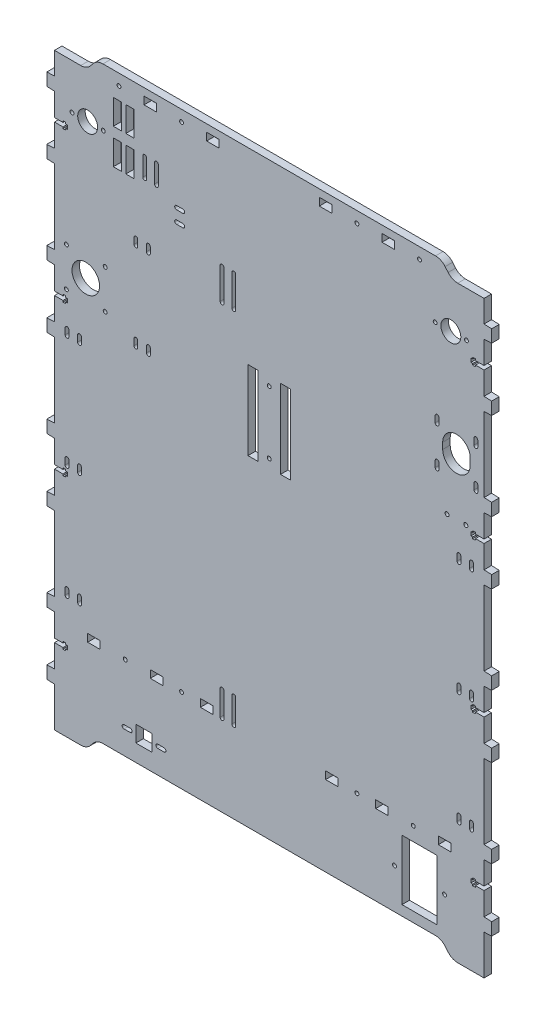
SolidWorks part; units mm, degrees
ref_plane "Спереди" through (0, 0, 0) normal (0, 0, 1) x (1, 0, 0)
ref_plane "Сверху" through (0, 0, 0) normal (0, 1, 0) x (1, 0, 0)
ref_plane "Справа" through (0, 0, 0) normal (1, 0, 0) x (0, 0, -1)
sketch "Эскиз1" plane through (0, 0, 0) normal (0, 0, 1) x (1, 0, 0)
  line L0 (161, 62) -> (177.8027, 62) construction
  line L1 (0, 77) -> (151.5411, 77) construction
  line L2 (157.5, 434) -> (132.5, 434) construction
  line L3 (85, 80.05) -> (95, 80.05)
  line L4 (95, 73.95) -> (85, 73.95)
  line L5 (85, 73.95) -> (85, 80.05)
  line L6 (95, 80.05) -> (95, 73.95)
  line L7 (135, 80.05) -> (145, 80.05)
  line L8 (145, 73.95) -> (135, 73.95)
  line L9 (135, 73.95) -> (135, 80.05)
  line L10 (145, 80.05) -> (145, 73.95)
  line L11 (9, 298.5) -> (0, 298.5) construction
  line L12 (177.6, 37) -> (162.5, 37) construction
  line L13 (171.5, 92.25) -> (177.6, 92)
  line L14 (177.6, 82) -> (171.5, 81.75)
  line L15 (177.6, 92) -> (177.6, 82)
  line L16 (162.5, 63.55) -> (161, 63.55)
  line L17 (162.5, 64.75) -> (162.5, 63.55)
  line L18 (164.7, 64.75) -> (162.5, 64.75)
  line L19 (164.7, 63.55) -> (164.7, 64.75)
  line L20 (100, 468.05) -> (90, 468.05)
  line L21 (90, 468.05) -> (90, 474.15)
  line L22 (90, 474.15) -> (100, 474.15)
  line L23 (100, 474.15) -> (100, 468.05)
  line L24 (50, 468.05) -> (40, 468.05)
  line L25 (40, 468.05) -> (40, 474.15)
  line L26 (40, 474.15) -> (50, 474.15)
  line L27 (50, 474.15) -> (50, 468.05)
  line L28 (55, 73.95) -> (45, 73.95)
  line L29 (45, 73.95) -> (45, 80.05)
  line L30 (45, 80.05) -> (55, 80.05)
  line L31 (55, 80.05) -> (55, 73.95)
  line L32 (171.5, 63.55) -> (164.7, 63.55)
  line L33 (171.5, 81.75) -> (171.5, 63.55)
  line L34 (171.5, 212.25) -> (177.6, 212)
  line L35 (0, 471.1) -> (120, 471.1) construction
  line L36 (-150.5, 0) -> (-171.5, 0)
  line L37 (-140.4433, 6.4279) -> (-142.8396, 3.5721)
  line L38 (-55, 80.05) -> (-55, 73.95)
  line L39 (-45, 80.05) -> (-55, 80.05)
  line L40 (-132.7829, 10) -> (132.7829, 10)
  line L41 (140.4433, 6.4279) -> (142.8396, 3.5721)
  line L42 (150.5, 0) -> (171.5, 0)
  line L43 (171.5, 0) -> (171.5, 31.75)
  line L44 (171.5, 31.75) -> (177.6, 32)
  line L45 (177.6, 32) -> (177.6, 42)
  line L46 (177.6, 42) -> (171.5, 42.25)
  line L47 (171.5, 42.25) -> (171.5, 60.45)
  line L48 (171.5, 60.45) -> (164.7, 60.45)
  line L49 (164.7, 60.45) -> (164.7, 59.25)
  line L50 (164.7, 59.25) -> (162.5, 59.25)
  line L51 (162.5, 59.25) -> (162.5, 60.45)
  line L52 (162.5, 60.45) -> (161, 60.45)
  line L53 (161, 60.45) -> (161, 63.55)
  line L54 (-45, 73.95) -> (-45, 80.05)
  line L55 (-55, 73.95) -> (-45, 73.95)
  line L56 (-95, 80.05) -> (-95, 73.95)
  line L57 (-85, 73.95) -> (-85, 80.05)
  line L58 (-95, 73.95) -> (-85, 73.95)
  line L59 (-85, 80.05) -> (-95, 80.05)
  line L60 (177.6, 212) -> (177.6, 202)
  line L61 (-177.6, 442) -> (-171.5, 441.75)
  line L62 (-171.5, 470) -> (-171.5, 452.25)
  line L63 (177.6, 202) -> (171.5, 201.75)
  line L64 (171.5, 201.75) -> (171.5, 183.55)
  line L65 (171.5, 183.55) -> (164.7, 183.55)
  line L66 (164.7, 184.75) -> (162.5, 184.75)
  line L67 (171.5, 180.45) -> (164.7, 180.45)
  line L68 (171.5, 162.25) -> (171.5, 180.45)
  line L69 (177.6, 162) -> (171.5, 162.25)
  line L70 (177.6, 152) -> (177.6, 162)
  line L71 (171.5, 151.75) -> (177.6, 152)
  line L72 (162.5, 183.55) -> (161, 183.55)
  line L73 (162.5, 184.75) -> (162.5, 183.55)
  line L74 (164.7, 183.55) -> (164.7, 184.75)
  line L75 (161, 180.45) -> (161, 183.55)
  line L76 (162.5, 180.45) -> (161, 180.45)
  line L77 (162.5, 179.25) -> (162.5, 180.45)
  line L78 (164.7, 179.25) -> (162.5, 179.25)
  line L79 (164.7, 180.45) -> (164.7, 179.25)
  line L80 (171.5, 332.25) -> (177.6, 332)
  line L81 (177.6, 332) -> (177.6, 322)
  line L82 (177.6, 322) -> (171.5, 321.75)
  line L83 (171.5, 321.75) -> (171.5, 303.55)
  line L84 (171.5, 303.55) -> (164.7, 303.55)
  line L85 (164.7, 304.75) -> (162.5, 304.75)
  line L86 (171.5, 300.45) -> (164.7, 300.45)
  line L87 (171.5, 282.25) -> (171.5, 300.45)
  line L88 (177.6, 282) -> (171.5, 282.25)
  line L89 (177.6, 272) -> (177.6, 282)
  line L90 (171.5, 271.75) -> (177.6, 272)
  line L91 (162.5, 303.55) -> (161, 303.55)
  line L92 (162.5, 304.75) -> (162.5, 303.55)
  line L93 (164.7, 303.55) -> (164.7, 304.75)
  line L94 (161, 300.45) -> (161, 303.55)
  line L95 (162.5, 300.45) -> (161, 300.45)
  line L96 (162.5, 299.25) -> (162.5, 300.45)
  line L97 (164.7, 299.25) -> (162.5, 299.25)
  line L98 (164.7, 300.45) -> (164.7, 299.25)
  line L99 (171.5, 452.25) -> (177.6, 452)
  line L100 (177.6, 452) -> (177.6, 442)
  line L101 (177.6, 442) -> (171.5, 441.75)
  line L102 (171.5, 441.75) -> (171.5, 423.55)
  line L103 (171.5, 423.55) -> (164.7, 423.55)
  line L104 (171.5, 470) -> (150.5, 470)
  line L105 (142.8396, 473.5721) -> (140.4433, 476.4279)
  line L106 (132.7829, 480) -> (-132.7829, 480)
  line L107 (164.7, 424.75) -> (162.5, 424.75)
  line L108 (171.5, 420.45) -> (164.7, 420.45)
  line L109 (171.5, 402.25) -> (171.5, 420.45)
  line L110 (177.6, 402) -> (171.5, 402.25)
  line L111 (177.6, 392) -> (177.6, 402)
  line L112 (171.5, 391.75) -> (177.6, 392)
  line L113 (162.5, 423.55) -> (161, 423.55)
  line L114 (162.5, 424.75) -> (162.5, 423.55)
  line L115 (164.7, 423.55) -> (164.7, 424.75)
  line L116 (161, 420.45) -> (161, 423.55)
  line L117 (162.5, 420.45) -> (161, 420.45)
  line L118 (162.5, 419.25) -> (162.5, 420.45)
  line L119 (164.7, 419.25) -> (162.5, 419.25)
  line L120 (164.7, 420.45) -> (164.7, 419.25)
  line L121 (171.5, 470) -> (171.5, 452.25)
  line L122 (171.5, 391.75) -> (171.5, 332.25)
  line L123 (171.5, 271.75) -> (171.5, 212.25)
  line L124 (-177.6, 452) -> (-177.6, 442)
  line L125 (-171.5, 452.25) -> (-177.6, 452)
  line L126 (-171.5, 441.75) -> (-171.5, 423.55)
  line L127 (-171.5, 420.45) -> (-164.7, 420.45)
  line L128 (-171.5, 423.55) -> (-164.7, 423.55)
  line L129 (-164.7, 420.45) -> (-164.7, 419.25)
  line L130 (-164.7, 419.25) -> (-162.5, 419.25)
  line L131 (-162.5, 419.25) -> (-162.5, 420.45)
  line L132 (-162.5, 420.45) -> (-161, 420.45)
  line L133 (-161, 420.45) -> (-161, 423.55)
  line L134 (-171.5, 391.75) -> (-177.6, 392)
  line L135 (171.5, 151.75) -> (171.5, 92.25)
  line L136 (-177.6, 392) -> (-177.6, 402)
  line L137 (-177.6, 402) -> (-171.5, 402.25)
  line L138 (-164.7, 423.55) -> (-164.7, 424.75)
  line L139 (-162.5, 424.75) -> (-162.5, 423.55)
  line L140 (-162.5, 423.55) -> (-161, 423.55)
  line L141 (-164.7, 424.75) -> (-162.5, 424.75)
  line L142 (-171.5, 420.45) -> (-171.5, 402.25)
  line L143 (-171.5, 391.75) -> (-171.5, 332.25)
  line L144 (-164.7, 300.45) -> (-164.7, 299.25)
  line L145 (-145, 80.05) -> (-145, 73.95)
  line L146 (-135, 73.95) -> (-135, 80.05)
  line L147 (-145, 73.95) -> (-135, 73.95)
  line L148 (-135, 80.05) -> (-145, 80.05)
  line L149 (-50, 474.15) -> (-50, 468.05)
  line L150 (-40, 474.15) -> (-50, 474.15)
  line L151 (-40, 468.05) -> (-40, 474.15)
  line L152 (-50, 468.05) -> (-40, 468.05)
  line L153 (-100, 474.15) -> (-100, 468.05)
  line L154 (-90, 474.15) -> (-100, 474.15)
  line L155 (-90, 468.05) -> (-90, 474.15)
  line L156 (-100, 468.05) -> (-90, 468.05)
  line L158 (-142.8396, 473.5721) -> (-140.4433, 476.4279)
  line L159 (-171.5, 470) -> (-150.5, 470)
  line L160 (-164.7, 299.25) -> (-162.5, 299.25)
  line L161 (-162.5, 299.25) -> (-162.5, 300.45)
  line L162 (-162.5, 300.45) -> (-161, 300.45)
  line L163 (-161, 300.45) -> (-161, 303.55)
  line L164 (-164.7, 303.55) -> (-164.7, 304.75)
  line L165 (-162.5, 304.75) -> (-162.5, 303.55)
  line L166 (-162.5, 303.55) -> (-161, 303.55)
  line L167 (-171.5, 271.75) -> (-177.6, 272)
  line L168 (-177.6, 272) -> (-177.6, 282)
  line L169 (-177.6, 282) -> (-171.5, 282.25)
  line L170 (-171.5, 282.25) -> (-171.5, 300.45)
  line L171 (-171.5, 300.45) -> (-164.7, 300.45)
  line L172 (-114.5, 441) -> (-114.5, 461)
  line L173 (-114.5, 461) -> (-108.1, 461)
  line L174 (-108.1, 461) -> (-108.1, 441)
  line L175 (-108.1, 441) -> (-114.5, 441)
  line L176 (-124.5, 441) -> (-124.5, 461)
  line L177 (-124.5, 461) -> (-118.1, 461)
  line L178 (-118.1, 461) -> (-118.1, 441)
  line L179 (-118.1, 441) -> (-124.5, 441)
  line L180 (-124.5, 413) -> (-124.5, 433)
  line L181 (-124.5, 433) -> (-118.1, 433)
  line L182 (-118.1, 433) -> (-118.1, 413)
  line L183 (-118.1, 413) -> (-124.5, 413)
  line L184 (-114.5, 413) -> (-114.5, 433)
  line L185 (-114.5, 433) -> (-108.1, 433)
  line L186 (-108.1, 433) -> (-108.1, 413)
  line L187 (-108.1, 413) -> (-114.5, 413)
  line L188 (-164.7, 304.75) -> (-162.5, 304.75)
  line L189 (-171.5, 303.55) -> (-164.7, 303.55)
  line L190 (-171.5, 321.75) -> (-171.5, 303.55)
  line L191 (-177.6, 322) -> (-171.5, 321.75)
  line L192 (-177.6, 332) -> (-177.6, 322)
  line L193 (-171.5, 332.25) -> (-177.6, 332)
  line L194 (-171.5, 151.75) -> (-171.5, 92.25)
  line L195 (-171.5, 271.75) -> (-171.5, 212.25)
  line L196 (-164.7, 180.45) -> (-164.7, 179.25)
  line L197 (-17, 267) -> (-9, 267)
  line L198 (-17, 330) -> (-17, 267)
  line L199 (-9, 330) -> (-17, 330)
  line L200 (-9, 267) -> (-9, 330)
  line L201 (-164.7, 179.25) -> (-162.5, 179.25)
  line L202 (-162.5, 179.25) -> (-162.5, 180.45)
  line L203 (-162.5, 180.45) -> (-161, 180.45)
  line L204 (9, 267) -> (9, 330)
  line L205 (9, 330) -> (17, 330)
  line L206 (17, 330) -> (17, 267)
  line L207 (17, 267) -> (9, 267)
  line L208 (-161, 180.45) -> (-161, 183.55)
  line L209 (-164.7, 183.55) -> (-164.7, 184.75)
  line L210 (-162.5, 184.75) -> (-162.5, 183.55)
  line L211 (-162.5, 183.55) -> (-161, 183.55)
  line L212 (-171.5, 151.75) -> (-177.6, 152)
  line L213 (-177.6, 152) -> (-177.6, 162)
  line L214 (0, 636.9153) -> (0, 0) construction
  line L215 (0, 0) -> (385.9726, 0) construction
  line L216 (-177.6, 162) -> (-171.5, 162.25)
  line L217 (-171.5, 162.25) -> (-171.5, 180.45)
  line L218 (-171.5, 180.45) -> (-164.7, 180.45)
  line L219 (-164.7, 184.75) -> (-162.5, 184.75)
  line L220 (-171.5, 183.55) -> (-164.7, 183.55)
  line L221 (-171.5, 201.75) -> (-171.5, 183.55)
  line L222 (-177.6, 202) -> (-171.5, 201.75)
  line L223 (-177.6, 212) -> (-177.6, 202)
  line L224 (-161, 60.45) -> (-161, 63.55)
  line L225 (-162.5, 60.45) -> (-161, 60.45)
  line L226 (-162.5, 59.25) -> (-162.5, 60.45)
  line L227 (-164.7, 59.25) -> (-162.5, 59.25)
  line L228 (-164.7, 60.45) -> (-164.7, 59.25)
  line L229 (-171.5, 60.45) -> (-164.7, 60.45)
  line L230 (-171.5, 42.25) -> (-171.5, 60.45)
  line L231 (-177.6, 42) -> (-171.5, 42.25)
  line L232 (-177.6, 32) -> (-177.6, 42)
  line L233 (-171.5, 31.75) -> (-177.6, 32)
  line L234 (-171.5, 0) -> (-171.5, 31.75)
  line L235 (-171.5, 212.25) -> (-177.6, 212)
  line L236 (-171.5, 81.75) -> (-171.5, 63.55)
  line L237 (-171.5, 63.55) -> (-164.7, 63.55)
  line L238 (-164.7, 63.55) -> (-164.7, 64.75)
  line L239 (-164.7, 64.75) -> (-162.5, 64.75)
  line L240 (-162.5, 64.75) -> (-162.5, 63.55)
  line L241 (-162.5, 63.55) -> (-161, 63.55)
  line L242 (-177.6, 92) -> (-177.6, 82)
  line L243 (-177.6, 82) -> (-171.5, 81.75)
  line L244 (-171.5, 92.25) -> (-177.6, 92)
  line L245 (161, 422) -> (174.1579, 422) construction
  circle A0 centre (0, 273.5) radius 1.55
  arc A1 (-142.8396, 3.5721) -> (-150.5, 0) centre (-150.5, 10) cw
  circle A2 centre (132.5, 434) radius 1.55
  circle A3 centre (145, 434) radius 7.95
  circle A4 centre (115, 77) radius 1.55
  circle A5 centre (70, 471.1) radius 1.55
  arc A6 (-132.7829, 10) -> (-140.4433, 6.4279) centre (-132.7829, 0) ccw
  circle A7 centre (-70, 77) radius 1.55
  circle A8 centre (-115, 77) radius 1.55
  circle A9 centre (120, 471.1) radius 1.55
  circle A10 centre (70, 77) radius 1.55
  circle A11 centre (157.5, 434) radius 1.55
  circle A12 centre (-70, 471.1) radius 1.55
  arc A13 (-140.4433, 476.4279) -> (-132.7829, 480) centre (-132.7829, 470) cw
  arc A14 (-150.5, 470) -> (-142.8396, 473.5721) centre (-150.5, 480) ccw
  arc A15 (132.7829, 10) -> (140.4433, 6.4279) centre (132.7829, 0) cw
  arc A16 (142.8396, 3.5721) -> (150.5, 0) centre (150.5, 10) ccw
  arc A17 (150.5, 470) -> (142.8396, 473.5721) centre (150.5, 480) cw
  arc A18 (140.4433, 476.4279) -> (132.7829, 480) centre (132.7829, 470) ccw
  circle A19 centre (-132.5, 434) radius 1.55
  circle A20 centre (-120, 471.1) radius 1.55
  circle A21 centre (-157.5, 434) radius 1.55
  circle A22 centre (0, 323.5) radius 1.55
  circle A23 centre (-145, 434) radius 7.95
  point P6 (45, 77)
  point P58 (145, 434)
  point P60 (40, 471.1)
  point P61 (90, 471.1)
  point P90 (0, 10)
  point P173 (135, 77)
  dimension "D4" = 10
  dimension "D12" = 3.1
  dimension "D13" = 15.9
  dimension "D14" = 4
  dimension "D15" = 45
  dimension "D17" = 140
  dimension "D34" = 36
  dimension "D45" = 290
  dimension "D46" = 20
  dimension "D47" = 20
  dimension "D48" = 50
  dimension "D1" = 171.5
  dimension "D2" = 480
  dimension "D3" = 20
  dimension "D5" = 50
  dimension "D6" = 21
  dimension "D7" = 58
  dimension "D8" = 6.1
  dimension "D9" = 77
  dimension "D10" = 10
  dimension "D11" = 6.1
  dimension "D16" = 90
  dimension "D19" = 40
  dimension "D20" = 63
  dimension "D21" = 8
  dimension "D22" = 18
  dimension "D23" = 150
  dimension "D24" = 25
  dimension "D25" = 10
  dimension "D26" = 25
  dimension "D27" = 10.5
  dimension "D28" = 10.5
  dimension "D29" = 3.1
  dimension "D30" = 2.2
  dimension "D31" = 1.5
  dimension "D32" = 5.5
  dimension "D33" = 25
  dimension "D35" = 8.9
  dimension "D36" = 10
  dimension "D37" = 50
  dimension "D38" = 6.4
  dimension "D39" = 20
  dimension "D40" = 8
  dimension "D41" = 3.6
  dimension "D42" = 19
  dimension "D43" = 120
  dimension "D44" = 47
  dimension "D18" = 50
extrude "Бобышка-Вытянуть1" add sketch "Эскиз1" against normal blind 6
sketch "Эскиз3" plane through (0, 0, 0) normal (0, 0, 1) x (1, 0, 0)
  line L0 (106, 42) -> (140, 42) construction
  line L1 (106, 66) -> (134, 66)
  line L2 (106, 66) -> (106, 18)
  line L3 (106, 18) -> (134, 18)
  line L4 (134, 66) -> (134, 18)
  line L5 (120, 66) -> (120, 18) construction
  line L6 (-132.7829, 10) -> (132.7829, 10) construction
  circle A0 centre (140, 42) radius 1.55
  circle A1 centre (100, 42) radius 1.55
  dimension "D1" = 3.1
  dimension "D2" = 120
  dimension "D3" = 40
  dimension "D4" = 48
  dimension "D5" = 28
  dimension "D6" = 32
extrude "Вырез-Вытянуть2" cut sketch "Эскиз3" against normal through all
sketch "Эскиз4" plane through (0, 0, 0) normal (0, 0, 1) x (1, 0, 0)
  line L0 (149.5, 349) -> (149.5, 354) construction
  line L1 (134, 336) -> (165, 336) construction
  line L2 (134, 336) -> (134, 367) construction
  line L3 (134, 367) -> (165, 367) construction
  line L4 (165, 336) -> (165, 367) construction
  line L5 (134, 336) -> (165, 367) construction
  line L6 (134, 367) -> (165, 336) construction
  line L7 (138.5, 349) -> (138.5, 354)
  line L8 (160.5, 349) -> (160.5, 354)
  line L9 (134, 364.5) -> (134, 369.5) construction
  line L10 (132.5, 364.5) -> (132.5, 369.5)
  line L11 (135.5, 364.5) -> (135.5, 369.5)
  line L12 (165, 364.5) -> (165, 369.5) construction
  line L13 (163.5, 364.5) -> (163.5, 369.5)
  line L14 (166.5, 364.5) -> (166.5, 369.5)
  line L15 (134, 338.5) -> (134, 333.5) construction
  line L16 (135.5, 338.5) -> (135.5, 333.5)
  line L17 (132.5, 338.5) -> (132.5, 333.5)
  line L18 (165, 338.5) -> (165, 333.5) construction
  line L19 (166.5, 338.5) -> (166.5, 333.5)
  line L20 (163.5, 338.5) -> (163.5, 333.5)
  line L21 (171.5, 332.25) -> (171.5, 391.75) construction
  line L22 (171.5, 470) -> (150.5, 470) construction
  arc A0 (138.5, 349) -> (160.5, 349) centre (149.5, 349) ccw
  arc A1 (160.5, 354) -> (138.5, 354) centre (149.5, 354) ccw
  arc A2 (132.5, 364.5) -> (135.5, 364.5) centre (134, 364.5) ccw
  arc A3 (135.5, 369.5) -> (132.5, 369.5) centre (134, 369.5) ccw
  arc A4 (163.5, 364.5) -> (166.5, 364.5) centre (165, 364.5) ccw
  arc A5 (166.5, 369.5) -> (163.5, 369.5) centre (165, 369.5) ccw
  arc A6 (135.5, 338.5) -> (132.5, 338.5) centre (134, 338.5) ccw
  arc A7 (132.5, 333.5) -> (135.5, 333.5) centre (134, 333.5) ccw
  arc A8 (166.5, 338.5) -> (163.5, 338.5) centre (165, 338.5) ccw
  arc A9 (163.5, 333.5) -> (166.5, 333.5) centre (165, 333.5) ccw
  point P0 (149.5, 351.5)
  point P7 (149.5, 351.5)
  point P13 (134, 367)
  point P20 (165, 367)
  point P27 (134, 336)
  point P34 (165, 336)
  dimension "D5" = 1.5
  dimension "D6" = 11
  dimension "D1" = 31
  dimension "D2" = 5
  dimension "D3" = 22
  dimension "D4" = 118.5
extrude "Вырез-Вытянуть3" cut sketch "Эскиз4" against normal through all
sketch "Эскиз5" plane through (0, 0, 0) normal (0, 0, 1) x (1, 0, 0)
  line L0 (-171.5, 391.75) -> (-171.5, 332.25) construction
  line L1 (-162, 309.5) -> (-131, 309.5) construction
  line L2 (-162, 309.5) -> (-162, 340.5) construction
  line L3 (-162, 340.5) -> (-131, 340.5) construction
  line L4 (-131, 309.5) -> (-131, 340.5) construction
  line L5 (-162, 309.5) -> (-131, 340.5) construction
  line L6 (-162, 340.5) -> (-131, 309.5) construction
  line L7 (-150.5, 470) -> (-171.5, 470) construction
  circle A0 centre (-146.5, 325) radius 11
  circle A2 centre (-162, 340.5) radius 1.55
  circle A3 centre (-131, 340.5) radius 1.55
  circle A4 centre (-131, 309.5) radius 1.55
  circle A5 centre (-162, 309.5) radius 1.55
  dimension "D2" = 22
  dimension "D3" = 3.1
  dimension "D1" = 31
  dimension "D4" = 25
  dimension "D5" = 145
extrude "Вырез-Вытянуть4" cut sketch "Эскиз5" against normal through all
sketch "Эскиз6" plane through (0, 0, 0) normal (0, 0, 1) x (1, 0, 0)
  line L0 (-156.5, -17.5983) -> (-156.5, 518.8173) construction
  line L1 (-171.5, 271.75) -> (-171.5, 212.25) construction
  line L2 (-161.5, 282.5) -> (-161.5, 277.5) construction
  line L3 (-160, 282.5) -> (-160, 277.5)
  line L4 (-163, 282.5) -> (-163, 277.5)
  line L5 (-150.5, 470) -> (-171.5, 470) construction
  line L6 (-151.5, 282.5) -> (-151.5, 277.5) construction
  line L7 (-153, 282.5) -> (-153, 277.5)
  line L8 (-150, 282.5) -> (-150, 277.5)
  line L9 (-161.5, 192.5) -> (-161.5, 187.5) construction
  line L10 (-160, 192.5) -> (-160, 187.5)
  line L11 (-163, 192.5) -> (-163, 187.5)
  line L12 (-151.5, 192.5) -> (-151.5, 187.5) construction
  line L13 (-153, 192.5) -> (-153, 187.5)
  line L14 (-150, 192.5) -> (-150, 187.5)
  line L15 (-161.5, 102.5) -> (-161.5, 97.5) construction
  line L16 (-160, 102.5) -> (-160, 97.5)
  line L17 (-163, 102.5) -> (-163, 97.5)
  line L18 (-151.5, 102.5) -> (-151.5, 97.5) construction
  line L19 (-153, 102.5) -> (-153, 97.5)
  line L20 (-150, 102.5) -> (-150, 97.5)
  line L21 (-106.5, 302.5) -> (-106.5, 297.5) construction
  line L22 (-105, 302.5) -> (-105, 297.5)
  line L23 (-108, 302.5) -> (-108, 297.5)
  line L24 (-101.5, 480) -> (-101.5, 283.1442) construction
  line L25 (132.7829, 480) -> (-132.7829, 480) construction
  line L26 (-106.5, 372.5) -> (-106.5, 367.5) construction
  line L27 (0, 0) -> (0, 535.469) construction
  line L28 (-96.5, 302.5) -> (-96.5, 297.5) construction
  line L29 (-98, 302.5) -> (-98, 297.5)
  line L30 (-95, 302.5) -> (-95, 297.5)
  line L31 (-171.5, 391.75) -> (-171.5, 332.25) construction
  line L32 (-105, 372.5) -> (-105, 367.5)
  line L33 (-108, 372.5) -> (-108, 367.5)
  line L34 (151.5, 102.5) -> (151.5, 97.5) construction
  line L35 (153, 102.5) -> (153, 97.5)
  line L36 (150, 102.5) -> (150, 97.5)
  line L37 (161.5, 102.5) -> (161.5, 97.5) construction
  line L38 (160, 102.5) -> (160, 97.5)
  line L39 (163, 102.5) -> (163, 97.5)
  line L40 (151.5, 192.5) -> (151.5, 187.5) construction
  line L41 (153, 192.5) -> (153, 187.5)
  line L42 (150, 192.5) -> (150, 187.5)
  line L43 (161.5, 192.5) -> (161.5, 187.5) construction
  line L44 (160, 192.5) -> (160, 187.5)
  line L45 (163, 192.5) -> (163, 187.5)
  line L46 (151.5, 282.5) -> (151.5, 277.5) construction
  line L47 (153, 282.5) -> (153, 277.5)
  line L48 (150, 282.5) -> (150, 277.5)
  line L49 (161.5, 282.5) -> (161.5, 277.5) construction
  line L50 (160, 282.5) -> (160, 277.5)
  line L51 (163, 282.5) -> (163, 277.5)
  line L52 (-96.5, 372.5) -> (-96.5, 367.5) construction
  line L53 (-98, 372.5) -> (-98, 367.5)
  line L54 (-95, 372.5) -> (-95, 367.5)
  arc A0 (-160, 282.5) -> (-163, 282.5) centre (-161.5, 282.5) ccw
  arc A1 (-163, 277.5) -> (-160, 277.5) centre (-161.5, 277.5) ccw
  arc A2 (-153, 282.5) -> (-150, 282.5) centre (-151.5, 282.5) cw
  arc A3 (-150, 277.5) -> (-153, 277.5) centre (-151.5, 277.5) cw
  arc A4 (-160, 192.5) -> (-163, 192.5) centre (-161.5, 192.5) ccw
  arc A5 (-163, 187.5) -> (-160, 187.5) centre (-161.5, 187.5) ccw
  arc A6 (-153, 192.5) -> (-150, 192.5) centre (-151.5, 192.5) cw
  arc A7 (-150, 187.5) -> (-153, 187.5) centre (-151.5, 187.5) cw
  arc A8 (-160, 102.5) -> (-163, 102.5) centre (-161.5, 102.5) ccw
  arc A9 (-163, 97.5) -> (-160, 97.5) centre (-161.5, 97.5) ccw
  arc A10 (-153, 102.5) -> (-150, 102.5) centre (-151.5, 102.5) cw
  arc A11 (-150, 97.5) -> (-153, 97.5) centre (-151.5, 97.5) cw
  arc A12 (-105, 302.5) -> (-108, 302.5) centre (-106.5, 302.5) ccw
  arc A13 (-108, 297.5) -> (-105, 297.5) centre (-106.5, 297.5) ccw
  arc A14 (-98, 302.5) -> (-95, 302.5) centre (-96.5, 302.5) cw
  arc A15 (-95, 297.5) -> (-98, 297.5) centre (-96.5, 297.5) cw
  arc A16 (-105, 372.5) -> (-108, 372.5) centre (-106.5, 372.5) ccw
  arc A17 (-108, 367.5) -> (-105, 367.5) centre (-106.5, 367.5) ccw
  arc A18 (-98, 372.5) -> (-95, 372.5) centre (-96.5, 372.5) cw
  arc A19 (-95, 367.5) -> (-98, 367.5) centre (-96.5, 367.5) cw
  arc A20 (153, 102.5) -> (150, 102.5) centre (151.5, 102.5) ccw
  arc A21 (150, 97.5) -> (153, 97.5) centre (151.5, 97.5) ccw
  arc A22 (160, 102.5) -> (163, 102.5) centre (161.5, 102.5) cw
  arc A23 (163, 97.5) -> (160, 97.5) centre (161.5, 97.5) cw
  arc A24 (153, 192.5) -> (150, 192.5) centre (151.5, 192.5) ccw
  arc A25 (150, 187.5) -> (153, 187.5) centre (151.5, 187.5) ccw
  arc A26 (160, 192.5) -> (163, 192.5) centre (161.5, 192.5) cw
  arc A27 (163, 187.5) -> (160, 187.5) centre (161.5, 187.5) cw
  arc A28 (153, 282.5) -> (150, 282.5) centre (151.5, 282.5) ccw
  arc A29 (150, 277.5) -> (153, 277.5) centre (151.5, 277.5) ccw
  arc A30 (160, 282.5) -> (163, 282.5) centre (161.5, 282.5) cw
  arc A31 (163, 277.5) -> (160, 277.5) centre (161.5, 277.5) cw
  point P6 (-161.5, 280)
  point P15 (-151.5, 280)
  point P23 (-161.5, 190)
  point P30 (-151.5, 190)
  point P37 (-161.5, 100)
  point P44 (-151.5, 100)
  point P52 (-106.5, 300)
  point P67 (-96.5, 300)
  point P73 (-106.5, 370)
  point P81 (151.5, 100)
  point P88 (161.5, 100)
  point P95 (151.5, 190)
  point P102 (161.5, 190)
  point P109 (151.5, 280)
  point P116 (161.5, 280)
  point P122 (-96.5, 370)
  dimension "D3" = 1.5
  dimension "D10" = 1.5
  dimension "D1" = 15
  dimension "D2" = 5
  dimension "D4" = 5
  dimension "D5" = 190
  dimension "D7" = 90
  dimension "D8" = 10
  dimension "D9" = 5
  dimension "D11" = 180
  dimension "D12" = 70
  dimension "D13" = 70
  dimension "D6" = 3
extrude "Вырез-Вытянуть5" cut sketch "Эскиз6" against normal through all
sketch "Эскиз8" plane through (0, 0, 0) normal (0, 0, 1) x (1, 0, 0)
  line L0 (-33, 10) -> (-33, 155.6621) construction
  line L1 (-132.7829, 10) -> (132.7829, 10) construction
  line L2 (-37.7, 95) -> (-37.7, 75) construction
  line L3 (-36.2, 95) -> (-36.2, 75)
  line L4 (-39.2, 95) -> (-39.2, 75)
  line L5 (-28.3, 95) -> (-28.3, 75) construction
  line L6 (-29.8, 95) -> (-29.8, 75)
  line L7 (-26.8, 95) -> (-26.8, 75)
  line L8 (-37.7, 387.5) -> (-37.7, 362.5) construction
  line L9 (-36.2, 387.5) -> (-36.2, 362.5)
  line L10 (-39.2, 387.5) -> (-39.2, 362.5)
  line L11 (-28.3, 387.5) -> (-28.3, 362.5) construction
  line L12 (-29.8, 387.5) -> (-29.8, 362.5)
  line L13 (-26.8, 387.5) -> (-26.8, 362.5)
  line L14 (132.7829, 480) -> (-132.7829, 480) construction
  arc A0 (-36.2, 95) -> (-39.2, 95) centre (-37.7, 95) ccw
  arc A1 (-39.2, 75) -> (-36.2, 75) centre (-37.7, 75) ccw
  arc A2 (-29.8, 95) -> (-26.8, 95) centre (-28.3, 95) cw
  arc A3 (-26.8, 75) -> (-29.8, 75) centre (-28.3, 75) cw
  arc A4 (-36.2, 387.5) -> (-39.2, 387.5) centre (-37.7, 387.5) ccw
  arc A5 (-39.2, 362.5) -> (-36.2, 362.5) centre (-37.7, 362.5) ccw
  arc A6 (-29.8, 387.5) -> (-26.8, 387.5) centre (-28.3, 387.5) cw
  arc A7 (-26.8, 362.5) -> (-29.8, 362.5) centre (-28.3, 362.5) cw
  point P6 (-37.7, 85)
  point P13 (-28.3, 85)
  point P21 (-37.7, 375)
  point P28 (-28.3, 375)
  dimension "D2" = 1.5
  dimension "D6" = 1.5
  dimension "D1" = 9.4
  dimension "D3" = 20
  dimension "D4" = 85
  dimension "D5" = 33
  dimension "D7" = 25
  dimension "D8" = 105
extrude "Вырез-Вытянуть7" cut sketch "Эскиз8" against normal through all
sketch "Эскиз9" plane through (0, 0, 0) normal (0, 0, 1) x (1, 0, 0)
  line L0 (-100, -4.5747) -> (-100, 50.9598) construction
  line L1 (-100, 30) -> (-89, 30) construction
  line L2 (-106.5, 23.5) -> (-93.5, 23.5)
  line L3 (-106.5, 23.5) -> (-106.5, 36.5)
  line L4 (-106.5, 36.5) -> (-93.5, 36.5)
  line L5 (-93.5, 23.5) -> (-93.5, 36.5)
  line L6 (-106.5, 23.5) -> (-93.5, 36.5) construction
  line L7 (-106.5, 36.5) -> (-93.5, 23.5) construction
  line L8 (-89, 30) -> (-84, 30) construction
  line L9 (-89, 31.5) -> (-84, 31.5)
  line L10 (-89, 28.5) -> (-84, 28.5)
  line L11 (-171.5, 0) -> (-150.5, 0) construction
  line L12 (-111, 30) -> (-116, 30) construction
  line L13 (-111, 31.5) -> (-116, 31.5)
  line L14 (-111, 28.5) -> (-116, 28.5)
  arc A0 (-89, 31.5) -> (-89, 28.5) centre (-89, 30) ccw
  arc A1 (-84, 28.5) -> (-84, 31.5) centre (-84, 30) ccw
  arc A2 (-111, 31.5) -> (-111, 28.5) centre (-111, 30) cw
  arc A3 (-116, 28.5) -> (-116, 31.5) centre (-116, 30) cw
  point P2 (-100, 30)
  point P9 (-86.5, 30)
  point P22 (-113.5, 30)
  dimension "D4" = 1.5
  dimension "D1" = 13
  dimension "D2" = 100
  dimension "D3" = 30
  dimension "D5" = 27
  dimension "D6" = 5
extrude "Вырез-Вытянуть8" cut sketch "Эскиз9" against normal through all
sketch "Эскиз10" plane through (0, 0, -6) normal (0, 0, -1) x (-1, 0, 0)
  line L0 (90.1, 432.5) -> (90.1, 417.5) construction
  line L1 (91.6, 432.5) -> (91.6, 417.5)
  line L2 (88.6, 432.5) -> (88.6, 417.5)
  line L3 (99.5, 432.5) -> (99.5, 417.5) construction
  line L4 (101, 432.5) -> (101, 417.5)
  line L5 (98, 432.5) -> (98, 417.5)
  line L9 (171.5, 420.45) -> (171.5, 402.25) construction
  line L10 (-132.7829, 480) -> (132.7829, 480) construction
  arc A0 (91.6, 432.5) -> (88.6, 432.5) centre (90.1, 432.5) ccw
  arc A1 (88.6, 417.5) -> (91.6, 417.5) centre (90.1, 417.5) ccw
  arc A2 (101, 432.5) -> (98, 432.5) centre (99.5, 432.5) ccw
  arc A3 (98, 417.5) -> (101, 417.5) centre (99.5, 417.5) ccw
  point P2 (90.1, 425)
  point P7 (99.5, 425)
  dimension "D1" = 1.5
  dimension "D2" = 9.4
  dimension "D3" = 15
  dimension "D4" = 72
  dimension "D5" = 55
extrude "Вырез-Вытянуть9" cut sketch "Эскиз10" against normal through all
sketch "Эскиз11" plane through (0, 0, -6) normal (0, 0, -1) x (-1, 0, 0)
  line L0 (69, 400) -> (74, 400) construction
  line L1 (69, 401.5) -> (74, 401.5)
  line L2 (69, 398.5) -> (74, 398.5)
  line L3 (69, 410) -> (74, 410) construction
  line L4 (69, 411.5) -> (74, 411.5)
  line L5 (69, 408.5) -> (74, 408.5)
  line L7 (-132.7829, 480) -> (132.7829, 480) construction
  line L8 (171.5, 391.75) -> (171.5, 332.25) construction
  arc A0 (69, 401.5) -> (69, 398.5) centre (69, 400) ccw
  arc A1 (74, 398.5) -> (74, 401.5) centre (74, 400) ccw
  arc A2 (69, 411.5) -> (69, 408.5) centre (69, 410) ccw
  arc A3 (74, 408.5) -> (74, 411.5) centre (74, 410) ccw
  point P2 (71.5, 400)
  point P9 (71.5, 410)
  dimension "D1" = 1.5
  dimension "D2" = 10
  dimension "D3" = 5
  dimension "D4" = 70
  dimension "D5" = 100
extrude "Вырез-Вытянуть10" cut sketch "Эскиз11" against normal through all
sketch "Эскиз12" plane through (0, 0, -6) normal (0, 0, -1) x (-1, 0, 0)
  line L0 (-149.5, 365) -> (-149.5, 299.5376) construction
  line L1 (-135.5, 333.5) -> (-135.5, 338.5) construction
  arc A0 (-138.5, 354) -> (-160.5, 354) centre (-149.5, 354) ccw construction
  circle A1 centre (-142, 306) radius 1.6
  circle A2 centre (-157, 306) radius 1.6
  point P10 (-135.5, 336)
  dimension "D1" = 30
  dimension "D2" = 3.2
  dimension "D3" = 15
extrude "Вырез-Вытянуть11" cut sketch "Эскиз12" against normal through all
